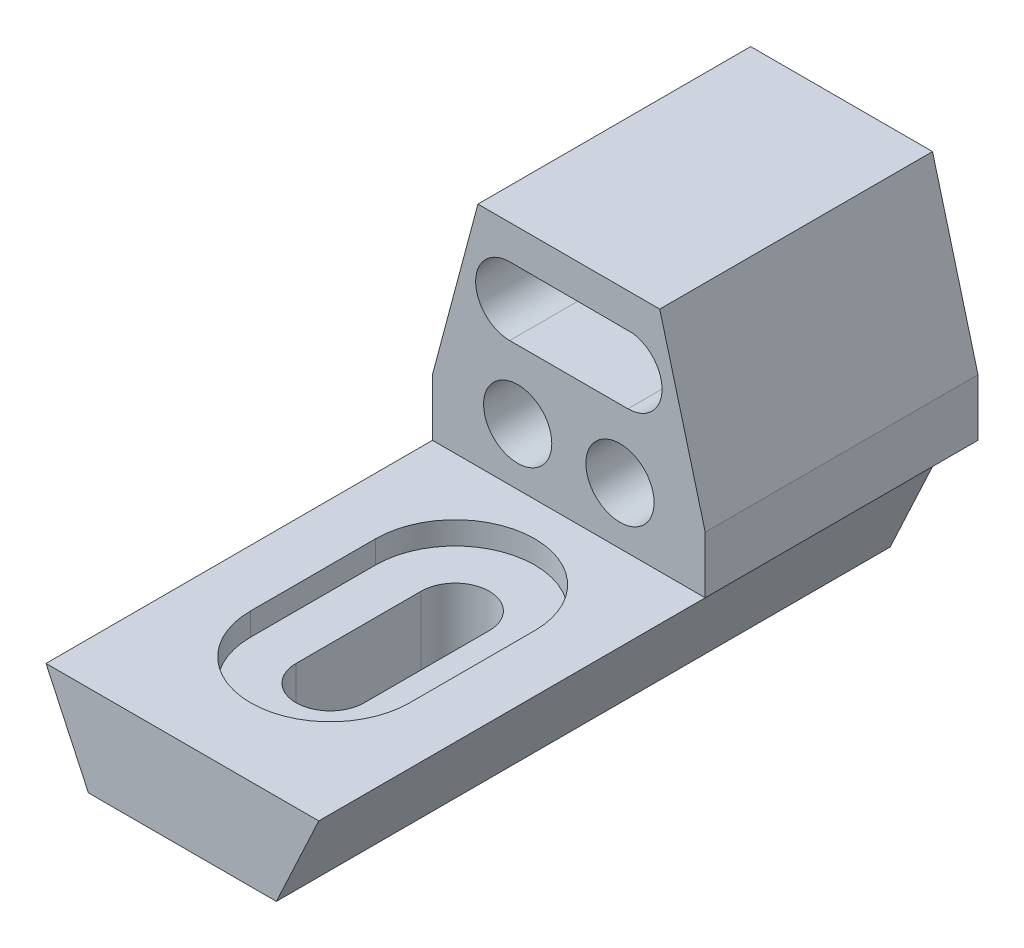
SolidWorks part; units mm, degrees
ref_plane "Front Plane" through (0, 0, 0) normal (0, 0, 1) x (1, 0, 0)
ref_plane "Top Plane" through (0, 0, 0) normal (0, 1, 0) x (1, 0, 0)
ref_plane "Right Plane" through (0, 0, 0) normal (1, 0, 0) x (0, 0, -1)
sketch "Sketch1" plane through (0, 0, 0) normal (0, 0, 1) x (1, 0, 0)
  line L0 (0, 0) -> (3048, 0)
  line L1 (3048, 0) -> (2574.2314, -1016)
  line L2 (2574.2314, -1016) -> (473.7686, -1016)
  line L3 (473.7686, -1016) -> (0, 0)
  dimension "D1" = 3048
  dimension "D2" = 115
  dimension "D3" = 115
  dimension "D4" = 1016
extrude "Boss-Extrude1" add sketch "Sketch1" against normal blind 6858
sketch "Sketch2" plane through (0, 0, 0) normal (0, 1, 0) x (1, 0, 0)
  line L0 (1524, 0) -> (1524, 1651) construction
  line L1 (3048, 0) -> (0, 0) construction
  line L2 (1524, 1651) -> (1524, 3048) construction
  line L3 (635, 3048) -> (635, 1651)
  line L4 (2413, 3048) -> (2413, 1651)
  arc A0 (635, 1651) -> (2413, 1651) centre (1524, 1651) ccw
  arc A1 (2413, 3048) -> (635, 3048) centre (1524, 3048) ccw
  dimension "D2" = 1778
  dimension "D4" = 1778
  dimension "D1" = 1651
  dimension "D3" = 1397
extrude "Cut-Extrude1" cut sketch "Sketch2" against normal blind 254
sketch "Sketch3" plane through (0, -254, 0) normal (0, 1, 0) x (1, 0, 0)
  line L0 (1143, 3048) -> (1143, 1651)
  line L1 (1905, 3048) -> (1905, 1651)
  arc A0 (1905, 3048) -> (1143, 3048) centre (1524, 3048) ccw
  arc A1 (1143, 1651) -> (1905, 1651) centre (1524, 1651) ccw
  dimension "D1" = 762
  dimension "D2" = 762
extrude "Cut-Extrude2" cut sketch "Sketch3" against normal through all
ref_plane "Plane1" through (0, 0, -4318) normal (0, 0, 1) x (1, 0, 0)
sketch "Sketch4" plane through (0, 0, -4318) normal (0, 0, 1) x (1, 0, 0)
  line L0 (0, 0) -> (0, 635)
  line L1 (0, 0) -> (3048, 0)
  line L2 (3048, 0) -> (3048, 635)
  line L3 (1524, 0) -> (1524, 2540) construction
  line L4 (1524, 2540) -> (508, 2540)
  line L5 (1524, 2540) -> (2540, 2540)
  line L6 (0, 635) -> (508, 2540)
  line L7 (2540, 2540) -> (3048, 635)
  dimension "D1" = 635
  dimension "D2" = 2540
  dimension "D3" = 1016
  dimension "D4" = 1016
  dimension "D5" = 635
extrude "Boss-Extrude2" add sketch "Sketch4" against normal blind 3048
sketch "Sketch5" plane through (0, 0, -4318) normal (0, 0, 1) x (1, 0, 0)
  line L0 (1524, 0) -> (952.5, 0) construction
  line L1 (0, 0) -> (3048, 0) construction
  line L2 (952.5, 0) -> (952.5, 635) construction
  line L3 (1524, 0) -> (1524, 1448.4544) construction
  line L4 (1524, 0) -> (2184.4, 0) construction
  line L5 (3048, 0) -> (0, 0) construction
  line L6 (2184.4, 0) -> (2184.4, 1778) construction
  line L7 (863.6, 2159) -> (2240.3235, 2154.8734)
  line L8 (863.6, 1397) -> (2184.4, 1397)
  circle A0 centre (952.5, 635) radius 381
  circle A1 centre (2095.5, 635) radius 381
  arc A2 (2184.4, 1397) -> (2130.7368, 2155.2019) centre (2184.4, 1778) ccw
  arc A3 (863.6, 1397) -> (865.884, 2158.9932) centre (863.6, 1778) cw
  dimension "D3" = 762
  dimension "D6" = 762
  dimension "D1" = 571.5
  dimension "D2" = 635
  dimension "D4" = 660.4
  dimension "D5" = 1778
extrude "Cut-Extrude3" cut sketch "Sketch5" against normal through all contours A3 L8 A2 L7 | A0 | A1
